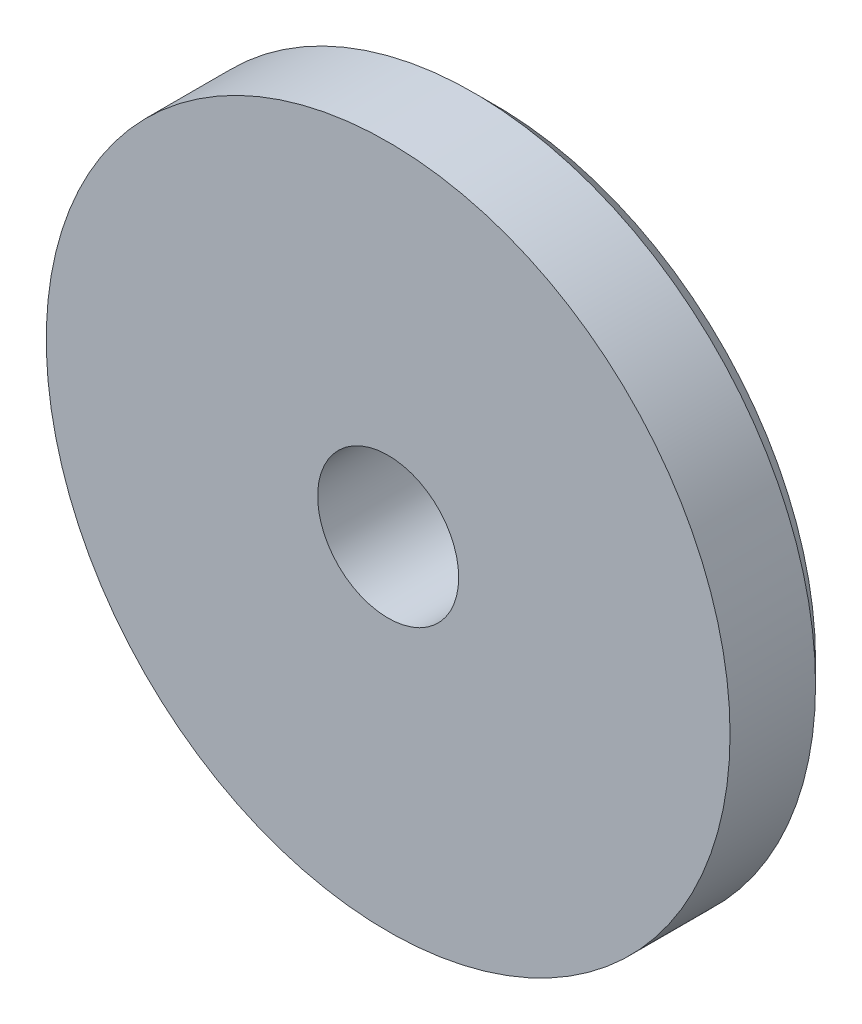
SolidWorks part; units mm, degrees
ref_plane "前视基准面" through (0, 0, 0) normal (0, 0, 1) x (1, 0, 0)
ref_plane "上视基准面" through (0, 0, 0) normal (0, 1, 0) x (1, 0, 0)
ref_plane "右视基准面" through (0, 0, 0) normal (1, 0, 0) x (0, 0, -1)
sketch "草图1" plane through (0, 0, 0) normal (1, 0, 0) x (0, 0, -1)
  line L0 (0, 3.3) -> (5, 3.3)
  line L1 (5, 3.3) -> (5, 15)
  line L2 (5, 15) -> (4, 16)
  line L3 (4, 16) -> (0, 16)
  line L4 (0, 16) -> (0, 3.3)
  line L5 (0, 0) -> (22.2641, 0) construction
  point P13 (0, 0)
  point P14 (5.0644, 1.7624)
  dimension "D1" = 3.3
  dimension "D2" = 5
  dimension "D3" = 16
  dimension "D4" = 1
  dimension "D5" = 1
revolve "旋转1" add sketch "草图1" angle 360 about L5
sketch "草图2" plane through (0, 0, -5) normal (0, 0, -1) x (-1, 0, 0)
  circle A0 centre (0, 7.3632) radius 1.8495
sketch "草图4" plane through (0, 0, 0) normal (0, 1, 0) x (1, 0, 0)
  line L0 (3, 6.6) -> (3, 5)
  line L1 (3.3, 5) -> (-3.3, 5) construction
  line L2 (3, 5) -> (4.6, 5)
  line L3 (15, 5) -> (-15, 5) construction
  line L4 (4.6, 5) -> (4.6, 6.6)
  line L5 (4.6, 6.6) -> (3, 6.6)
  line L6 (0, 0) -> (0, 11.0087) construction
  dimension "D1" = 1.6
  dimension "D2" = 1.6
  dimension "D3" = 3
revolve "旋转2" add sketch "草图4" angle 360 about L6
